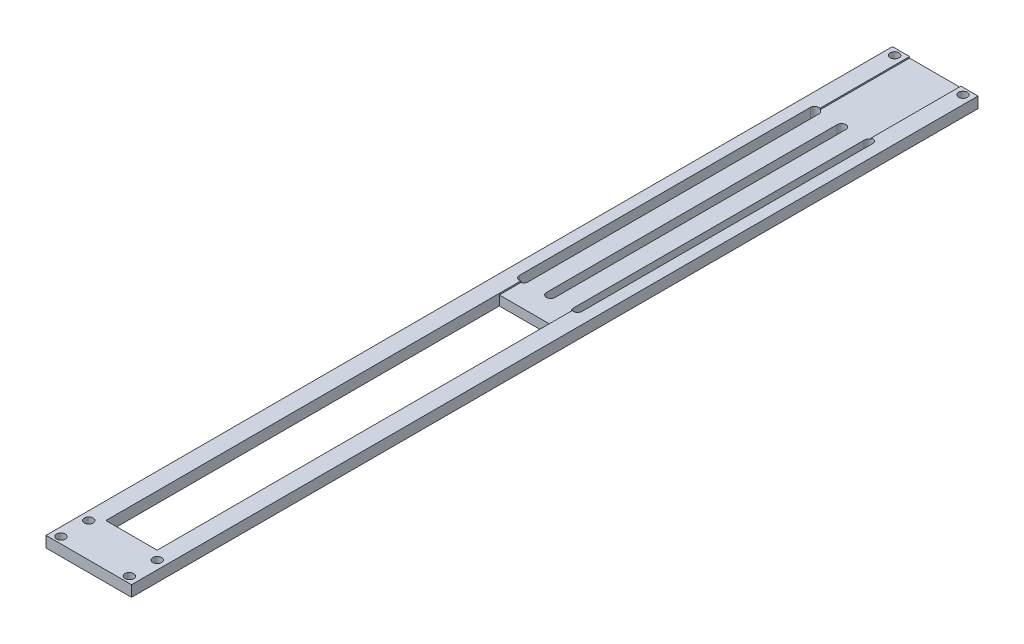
SolidWorks part; units mm, degrees
ref_plane "Front Plane" through (0, 0, 0) normal (0, 0, 1) x (1, 0, 0)
ref_plane "Top Plane" through (0, 0, 0) normal (0, 1, 0) x (1, 0, 0)
ref_plane "Right Plane" through (0, 0, 0) normal (1, 0, 0) x (0, 0, -1)
sketch "Sketch1" plane through (0, 0, 0) normal (0, 0, 1) x (1, 0, 0)
  line L1 (-15.875, 2.032) -> (15.875, 2.032)
  line L2 (-15.875, 2.032) -> (-15.875, -2.032)
  line L3 (-15.875, -2.032) -> (15.875, -2.032)
  line L4 (15.875, 2.032) -> (15.875, -2.032)
  line L5 (-15.875, 2.032) -> (15.875, -2.032) construction
  line L6 (-15.875, -2.032) -> (15.875, 2.032) construction
  point P0 (0, 0)
  dimension "D1" = 4.064
  dimension "D2" = 31.75
extrude "Boss-Extrude1" add sketch "Sketch1" along normal blind 314.198
sketch "Sketch2" plane through (0, 2.032, 0) normal (0, 1, 0) x (1, 0, 0)
  line L0 (-15.875, -314.198) -> (-15.875, 0) construction
  line L1 (-9.525, -152.273) -> (9.525, -152.273)
  line L2 (-9.525, -152.273) -> (-9.525, -298.323)
  line L3 (-9.525, -298.323) -> (9.525, -298.323)
  line L4 (9.525, -152.273) -> (9.525, -298.323)
  line L6 (15.875, -314.198) -> (-15.875, -314.198) construction
  point P8 (0, -314.198)
  dimension "D1" = 19.05
  dimension "D2" = 6.35
  dimension "D3" = 15.875
  dimension "D4" = 146.05
extrude "Cut-Extrude2" cut sketch "Sketch2" against normal blind 6.35
sketch "Sketch3" plane through (0, 2.032, 0) normal (0, 1, 0) x (1, 0, 0)
  line L1 (-9.525, -152.273) -> (9.525, -152.273)
  line L2 (-9.525, -152.273) -> (-9.525, 7.7978)
  line L3 (-9.525, 7.7978) -> (9.525, 7.7978)
  line L4 (9.525, -152.273) -> (9.525, 7.7978)
extrude "Cut-Extrude3" cut sketch "Sketch3" against normal blind 0.508
hole_wizard "#4 Clearance Hole1" positions "Sketch4" profile "Sketch5" hole size "#4" standard "ANSI Inch"
sketch "Sketch4" plane through (0, 2.032, 0) normal (0, 1, 0) x (1, 0, 0)
  line L0 (-15.875, -314.198) -> (-15.875, 0) construction
  line L1 (12.7, -301.498) -> (-12.7, -301.498)
  line L3 (15.875, -314.198) -> (-15.875, -314.198) construction
  point P0 (12.7, -301.498)
  point P2 (-12.7, -301.498)
  dimension "D1" = 25.4
  dimension "D2" = 3.175
  dimension "D3" = 12.7
sketch "Sketch5" plane through (12.7, 2.032, 301.498) normal (1, 0, 0) x (0, 0, 1)
  line L0 (0, 0) -> (0, 26.3806)
  line L1 (0, 26.3806) -> (1.6319, 25.4)
  line L2 (1.6319, 25.4) -> (1.6319, 0)
  line L5 (1.6319, 0) -> (0, 0)
  line L10 (0, 26.3806) -> (-1.632, 25.4) construction
  line L11 (0, -6.35) -> (0, 107.95) construction
  dimension "Hole Dia." = 3.2639
  dimension "Hole Depth" = 25.4
  dimension "Drill Angle" = 118
sketch "Sketch6" plane through (0, -2.032, 0) normal (0, -1, 0) x (1, 0, 0)
  line L0 (0.0145, 142.748) -> (0.0145, 34.798) construction
  line L1 (1.6145, 142.748) -> (1.6145, 34.798)
  line L2 (-1.5855, 142.748) -> (-1.5855, 34.798)
  line L4 (15.875, 314.198) -> (-15.875, 314.198) construction
  arc A0 (1.6145, 142.748) -> (-1.5855, 142.748) centre (0.0145, 142.748) ccw
  arc A1 (-1.5855, 34.798) -> (1.6145, 34.798) centre (0.0145, 34.798) ccw
  point P2 (0.0145, 88.773)
  dimension "D1" = 107.95
  dimension "D2" = 3.2
  dimension "D3" = 171.45
extrude "Cut-Extrude4" cut sketch "Sketch6" against normal blind 8.128
pattern_linear "LPattern1" count 2 spacing 10 along (-1, 0, 0) of "Cut-Extrude4"
pattern_linear "LPattern2" count 2 spacing 10 along (1, 0, 0) of "Cut-Extrude4"
hole_wizard "#4 Clearance Hole2" positions "Sketch7" profile "Sketch8" hole size "#4" standard "ANSI Inch"
sketch "Sketch7" plane through (0, 2.032, 0) normal (0, 1, 0) x (1, 0, 0)
  line L0 (15.875, 0) -> (9.525, 0) construction
  line L1 (-9.525, 0) -> (-15.875, 0) construction
  line L2 (12.7, -311.8167) -> (-12.7, -311.8167)
  line L4 (15.875, -314.198) -> (-15.875, -314.198) construction
  point P0 (12.7, -311.8167)
  point P2 (-12.7, -311.8167)
  point P4 (12.7, -2.3813)
  point P6 (-12.7, -2.3813)
  dimension "D1" = 2.3813
  dimension "D2" = 2.3813
  dimension "D3" = 25.4
  dimension "D4" = 2.3813
  dimension "D5" = 25.4
  dimension "D6" = 12.7
  dimension "D7" = 12.7
sketch "Sketch8" plane through (12.7, 2.032, 311.8167) normal (1, 0, 0) x (0, 0, 1)
  line L0 (0, 0) -> (0, 26.3806)
  line L1 (0, 26.3806) -> (1.6319, 25.4)
  line L2 (1.6319, 25.4) -> (1.6319, 0)
  line L5 (1.6319, 0) -> (0, 0)
  line L10 (0, 26.3806) -> (-1.632, 25.4) construction
  line L11 (0, -6.35) -> (0, 107.95) construction
  dimension "Hole Dia." = 3.2639
  dimension "Hole Depth" = 25.4
  dimension "Drill Angle" = 118
